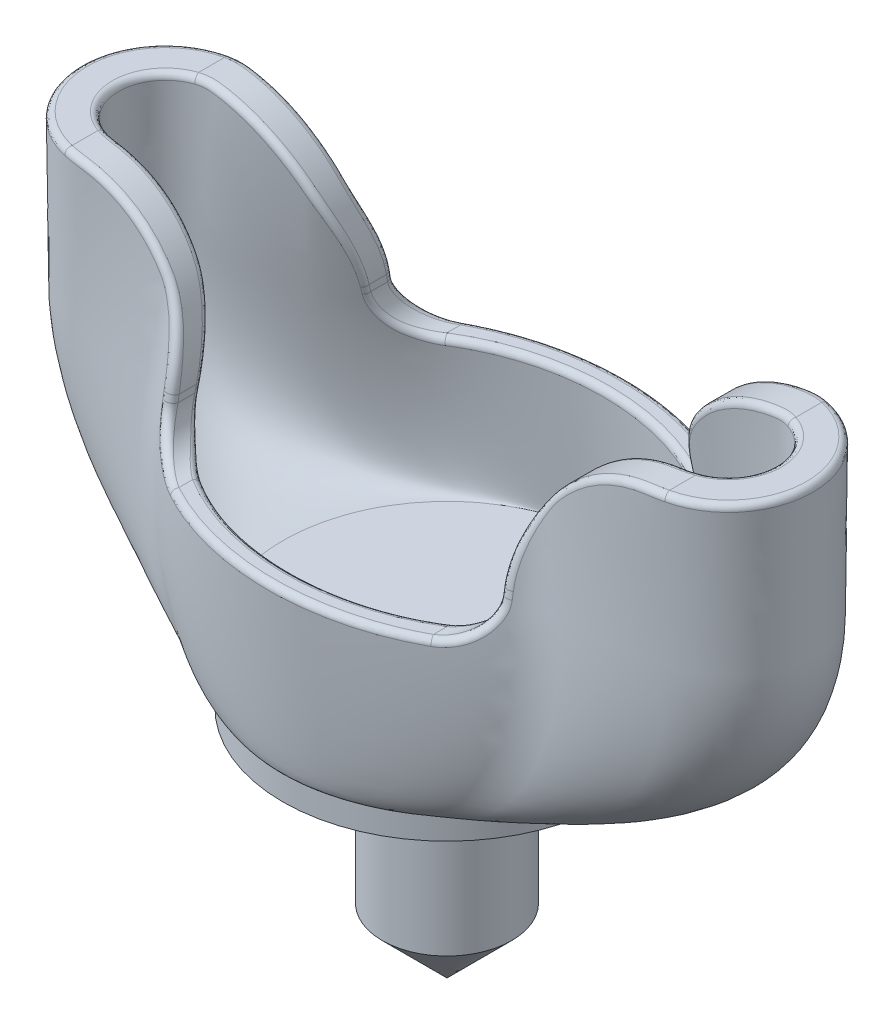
SolidWorks part; units mm, degrees
ref_plane "Front Plane" through (0, 0, 0) normal (0, 0, 1) x (1, 0, 0)
ref_plane "Top Plane" through (0, 0, 0) normal (0, 1, 0) x (1, 0, 0)
ref_plane "Right Plane" through (0, 0, 0) normal (1, 0, 0) x (0, 0, -1)
sketch "Sketch1" plane through (0, 0, 0) normal (0, 0, 1) x (1, 0, 0)
  line L0 (0, 10.7344) -> (0, -7.5424) construction
  line L1 (4.445, 5.334) -> (4.445, 6.5193)
  line L2 (-4.445, 0) -> (4.445, 0)
  line L3 (9.906, 10.16) -> (8.0857, 10.16)
  line L4 (-4.445, 5.334) -> (4.445, 5.334)
  line L5 (9.906, 10.16) -> (8.3762, 10.16) construction
  line L6 (9.906, 10.16) -> (9.906, 5.7504) construction
  line L7 (9.906, 10.16) -> (9.906, 6.1278)
  line L8 (4.445, 0) -> (4.445, 0.6667)
  line L9 (4.445, 0.6667) -> (0.3077, 0.6667) construction
  line L10 (-4.445, 0) -> (-4.445, 0.6667)
  line L11 (-9.906, 10.16) -> (-9.906, 6.1277)
  line L12 (-9.906, 10.16) -> (-8.0857, 10.16)
  line L13 (-4.445, 5.334) -> (-4.445, 6.5193)
  arc A5 (8.0857, 10.16) -> (4.445, 6.5193) centre (8.0857, 6.5193) ccw
  arc A6 (4.445, 0.6667) -> (9.906, 6.1278) centre (4.445, 6.1277) ccw
  arc A7 (-8.0857, 10.16) -> (-4.445, 6.5193) centre (-8.0857, 6.5193) cw
  arc A8 (-4.445, 0.6667) -> (-9.906, 6.1277) centre (-4.445, 6.1277) cw
  point P4 (0, 5.334)
  point P19 (0, 0)
  dimension "D2" = 0.6667
  dimension "D1" = 1.8203
  dimension "B" = 10.16
  dimension "A" = 19.812
  dimension "EE" = 8.89
  dimension "E" = 8.89
  dimension "G" = 5.334
ref_plane "Plane4" through (0, 10.16, 0) normal (0, 1, 0) x (-1, 0, 0)
ref_plane "Plane5" through (0, 0.6667, 0) normal (0, 1, 0) x (-1, 0, 0)
sketch "Sketch2" plane through (0, 10.16, 0) normal (0, 1, 0) x (-1, 0, 0)
  line L0 (4.445, 0) -> (-4.445, 0) construction
  line L1 (5.1243, -2.286) -> (7.62, -2.286)
  line L2 (0, 0) -> (14.2067, 0) construction
  line L3 (5.1243, 2.286) -> (7.62, 2.286)
  line L4 (0, 0) -> (0, 10.869) construction
  line L5 (0, 0) -> (0, -9.6836) construction
  line L6 (-5.1243, 2.286) -> (-7.62, 2.286)
  line L7 (-5.1243, -2.286) -> (-7.62, -2.286)
  arc A0 (4.2702, 2.7517) -> (-4.2702, 2.7517) centre (0, 0) ccw
  arc A1 (7.62, 2.286) -> (7.62, -2.286) centre (7.62, 0) cw
  arc A2 (-4.2702, -2.7517) -> (4.2702, -2.7517) centre (0, 0) ccw
  arc A3 (-7.62, 2.286) -> (-7.62, -2.286) centre (-7.62, 0) ccw
  arc A4 (-5.1243, 2.286) -> (-4.2702, 2.7517) centre (-5.1243, 3.302) ccw
  arc A5 (-5.1243, -2.286) -> (-4.2702, -2.7517) centre (-5.1243, -3.302) cw
  arc A6 (5.1243, 2.286) -> (4.2702, 2.7517) centre (5.1243, 3.302) cw
  arc A7 (5.1243, -2.286) -> (4.2702, -2.7517) centre (5.1243, -3.302) ccw
  point P20 (-4.5366, 2.286)
  point P23 (-4.5366, -2.286)
  point P26 (4.5366, 2.286)
  point P29 (4.5366, -2.286)
  dimension "F" = 10.16
  dimension "C" = 4.572
sketch "Sketch9" plane through (0, 0, 0) normal (0, 0, 1) x (1, 0, 0)
  line L0 (-9.906, 10.16) -> (-9.906, 6.1277) construction
  line L1 (-9.906, 10.16) -> (-9.906, 6.1277)
  arc A0 (-9.906, 6.1277) -> (-4.445, 0.6667) centre (-4.445, 6.1277) ccw construction
  arc A2 (-9.906, 6.1277) -> (-4.445, 0.6667) centre (-4.445, 6.1277) ccw
sketch "Sketch10" plane through (0, 0, 0) normal (0, 0, 1) x (1, 0, 0)
  line L0 (9.906, 10.16) -> (9.906, 6.1277) construction
  line L1 (9.906, 10.16) -> (9.906, 6.1277)
  arc A1 (4.445, 0.6668) -> (9.906, 6.1277) centre (4.445, 6.1277) ccw construction
  arc A2 (4.445, 0.6668) -> (9.906, 6.1277) centre (4.445, 6.1277) ccw
sketch "Sketch18" plane through (0, 0.6667, 0) normal (0, 1, 0) x (-1, 0, 0)
  circle A0 centre (0, 0) radius 4.445
loft "Loft2" add profiles "Sketch18", "Sketch2"
ref_plane "Plane6" through (0, 1.6827, 0) normal (0, 1, 0) x (-1, 0, 0)
sketch "Sketch20" plane through (0, 1.6827, 0) normal (0, 1, 0) x (-1, 0, 0)
  circle A0 centre (0, 0) radius 4.445 construction
  circle A1 centre (0, 0) radius 4.445
sketch "Sketch21" plane through (0, 10.16, 0) normal (0, 1, 0) x (-1, 0, 0)
  line L8 (-5.1243, 1.27) -> (-7.62, 1.27)
  line L9 (-7.62, -1.27) -> (-5.1243, -1.27)
  line L10 (5.1243, -1.27) -> (7.62, -1.27)
  line L11 (7.62, 1.27) -> (5.1243, 1.27)
  line L12 (-5.1243, 1.27) -> (-7.62, 1.27)
  line L13 (-7.62, -1.27) -> (-5.1243, -1.27)
  line L14 (5.1243, -1.27) -> (7.62, -1.27)
  line L15 (7.62, 1.27) -> (5.1243, 1.27)
  arc A16 (-7.62, 1.27) -> (-7.62, -1.27) centre (-7.62, 0) ccw
  arc A17 (-3.4162, -2.2013) -> (-5.1243, -1.27) centre (-5.1243, -3.302) ccw
  arc A18 (-3.4162, -2.2013) -> (3.4162, -2.2013) centre (0, 0) ccw
  arc A19 (5.1243, -1.27) -> (3.4162, -2.2013) centre (5.1243, -3.302) ccw
  arc A20 (7.62, -1.27) -> (7.62, 1.27) centre (7.62, 0) ccw
  arc A21 (3.4162, 2.2013) -> (5.1243, 1.27) centre (5.1243, 3.302) ccw
  arc A22 (3.4162, 2.2013) -> (-3.4162, 2.2013) centre (0, 0) ccw
  arc A23 (-5.1243, 1.27) -> (-3.4162, 2.2013) centre (-5.1243, 3.302) ccw
  arc A24 (-7.62, 1.27) -> (-7.62, -1.27) centre (-7.62, 0) ccw
  arc A25 (-3.4162, -2.2013) -> (-5.1243, -1.27) centre (-5.1243, -3.302) ccw
  arc A26 (-3.4162, -2.2013) -> (3.4162, -2.2013) centre (0, 0) ccw
  arc A27 (5.1243, -1.27) -> (3.4162, -2.2013) centre (5.1243, -3.302) ccw
  arc A28 (7.62, -1.27) -> (7.62, 1.27) centre (7.62, 0) ccw
  arc A29 (3.4162, 2.2013) -> (5.1243, 1.27) centre (5.1243, 3.302) ccw
  arc A30 (3.4162, 2.2013) -> (-3.4162, 2.2013) centre (0, 0) ccw
  arc A31 (-5.1243, 1.27) -> (-3.4162, 2.2013) centre (-5.1243, 3.302) ccw
sketch "Sketch22" plane through (0, 0, 0) normal (0, 0, 1) x (1, 0, 0)
  line L2 (-8.89, 10.16) -> (-8.89, 6.1277)
  line L3 (-8.89, 10.16) -> (-8.89, 6.1277)
  arc A2 (-8.89, 6.1277) -> (-4.445, 1.6827) centre (-4.445, 6.1277) ccw
  arc A3 (-8.89, 6.1277) -> (-4.445, 1.6827) centre (-4.445, 6.1277) ccw
sketch "Sketch23" plane through (0, 0, 0) normal (0, 0, 1) x (1, 0, 0)
  line L2 (8.89, 10.16) -> (8.89, 6.1277)
  line L3 (8.89, 10.16) -> (8.89, 6.1277)
  arc A2 (4.445, 1.6828) -> (8.89, 6.1277) centre (4.445, 6.1277) ccw
  arc A3 (4.445, 1.6828) -> (8.89, 6.1277) centre (4.445, 6.1277) ccw
loft "Cut-Loft1" cut profiles "Sketch20", "Sketch21"
sketch "Sketch14" plane through (0, 0, 0) normal (0, 0, 1) x (1, 0, 0)
  line L0 (0, 0) -> (0, -9.7552) construction
  line L2 (0, 0) -> (0, -6.35)
  line L3 (0, -6.35) -> (1.7526, -6.35)
  line L4 (1.7526, 0) -> (1.7526, -6.35)
  line L5 (1.7526, 0) -> (4.445, 0)
  line L6 (4.445, 0) -> (4.445, 0.6667)
  line L7 (4.445, 0.6667) -> (0, 0.6667)
  line L8 (0, 10.7344) -> (0, -7.5424) construction
  line L9 (6.9245, 0.6667) -> (-6.9245, 0.6667) construction
  line L10 (0, 0.6667) -> (0, 0)
  dimension "d1" = 3.5052
  dimension "L" = 6.35
revolve "Revolve1" add sketch "Sketch14" angle 360 about L0
sketch "Sketch16" plane through (0, 0, 0) normal (0, 0, 1) x (1, 0, 0)
  line L0 (-9.906, 10.16) -> (-9.906, 11.16)
  line L1 (-9.906, 11.16) -> (9.906, 11.16)
  line L2 (9.906, 11.16) -> (9.906, 10.16)
  line L10 (-4.445, 0) -> (4.445, 0)
  line L11 (4.445, 0) -> (4.445, 0.6667)
  line L12 (9.906, 6.1277) -> (9.906, 10.16)
  line L13 (9.906, 10.16) -> (8.0857, 10.16)
  line L14 (4.445, 6.5193) -> (4.445, 5.334)
  line L15 (4.445, 5.334) -> (-4.445, 5.334)
  line L16 (-4.445, 5.334) -> (-4.445, 6.5193)
  line L17 (-8.0857, 10.16) -> (-9.906, 10.16)
  line L18 (-9.906, 10.16) -> (-9.906, 6.1277)
  line L19 (-4.445, 0.6667) -> (-4.445, 0)
  line L23 (9.906, 10.16) -> (8.0857, 10.16)
  line L24 (4.445, 6.5193) -> (4.445, 5.334)
  line L25 (4.445, 5.334) -> (-4.445, 5.334)
  line L26 (-4.445, 5.334) -> (-4.445, 6.5193)
  line L27 (-8.0857, 10.16) -> (-9.906, 10.16)
  arc A4 (4.445, 0.6667) -> (9.906, 6.1277) centre (4.445, 6.1277) ccw
  arc A5 (8.0857, 10.16) -> (4.445, 6.5193) centre (8.0857, 6.5193) ccw
  arc A6 (-4.445, 6.5193) -> (-8.0857, 10.16) centre (-8.0857, 6.5193) ccw
  arc A7 (-9.906, 6.1277) -> (-4.445, 0.6667) centre (-4.445, 6.1277) ccw
  arc A9 (8.0857, 10.16) -> (4.445, 6.5193) centre (8.0857, 6.5193) ccw
  arc A10 (-4.445, 6.5193) -> (-8.0857, 10.16) centre (-8.0857, 6.5193) ccw
  dimension "D2" = 1
  dimension "D1" = 0
extrude "Cut-Extrude1" cut sketch "Sketch16" against normal through all and the other way through all
fillet "Fillet1" radius 1 4 edges at (4.445, 5.334, -2.924) (4.445, 5.334, 2.924) (-4.445, 5.334, -2.924) (-4.445, 5.334, 2.924)
fillet "Fillet2" radius 0.1693 32 edges at (-5.4656, 9.0471, -1.4153) (-5.968, 9.4808, 1.3386) (-4.1482, 5.623, -2.6418) (0.7192, 5.334, -4.1865) (4.2763, 5.7781, -2.5192) (5.4656, 9.0471, 1.4153) (5.968, 9.4808, -1.3386) (4.1482, 5.623, 2.6418) (-0.7192, 5.334, 4.1865) (-4.2763, 5.7781, 2.5192) (-5.3715, 8.9458, 2.3716) (-5.3444, 8.9152, -2.375) (-4.2761, 5.7779, -3.4455) (1.9112, 5.334, -4.5997) (4.1338, 5.609, -3.5649) (5.3444, 8.9152, 2.375) (5.3715, 8.9458, -2.3716) (4.2761, 5.7779, 3.4455) (-1.9112, 5.334, 4.5997) (-4.1338, 5.609, 3.5649)
sketch "Sketch27" plane through (0, 0, 0) normal (0, 0, 1) x (1, 0, 0)
  line L0 (0, 0) -> (0, -9.1725) construction
  line L1 (-4.445, 0) -> (4.445, 0) construction
  line L2 (0, -6.35) -> (1.7701, -4.5799)
  line L4 (1.7701, -4.5799) -> (1.7701, -6.3754)
  line L6 (-1.7526, -6.35) -> (1.7526, -6.35) construction
  line L7 (0, -6.35) -> (0, -6.3754)
  line L8 (0, -6.3754) -> (1.7701, -6.3754)
  dimension "D1" = 45
  dimension "D2" = 3.5403
  dimension "D3" = 0.0254
revolve "Cut-Revolve11" cut sketch "Sketch27" angle 360 about L0
sketch "Sketch26" plane through (0, 0, 0) normal (0, 0, 1) x (1, 0, 0)
  line L0 (0, 0) -> (0, -6.8807) construction
  line L1 (-1.7526, 0) -> (1.7526, 0) construction
  line L2 (1.2802, -0.2753) -> (1.7526, -0.0025)
  line L3 (1.7526, -0.0025) -> (1.7526, -0.5481)
  line L4 (1.7526, -0.5481) -> (1.2802, -0.2753)
  line L9 (1.2802, -0.2753) -> (1.2802, -1.0678) construction
  dimension "D1" = 3.5052
  dimension "D2" = 2.5603
  dimension "D3" = 0.0025
  dimension "pitch" = 0.7925
revolve "Cut-Revolve10" [suppressed] cut sketch "Sketch26" angle 360 about L0
pattern_linear "LPattern10" [suppressed] count 8 along (0, -1, 0)
equation "\"D1@Sketch1\" = (  \"A@Sketch1\" - \"EE@Sketch1\"  ) / 2 / 3"
equation "\"D2@Sketch1\" = \"G@Sketch1\" / 8"
equation "\"D1@LPattern10\" =\"L@Sketch14\" / \"pitch@Sketch26\" "
equation "\"EE@Sketch1\" = \"E@Sketch1\""
equation "\"LL@Cosmetic Thread1\" = \"L@Sketch14\""
equation "\"D1@Fillet2\" = \"T\" / 6"
equation "\"D1@Sketch26\" = \"d1@Sketch14\""
equation "\"D2@Sketch26\" = \"THD_MINOR@Cosmetic Thread1\""
equation "\"PITCH@LPattern10\" = \"pitch@Sketch26\""
equation "\"D2@Sketch27\" = \"d1@Sketch14\" * 1.01"
